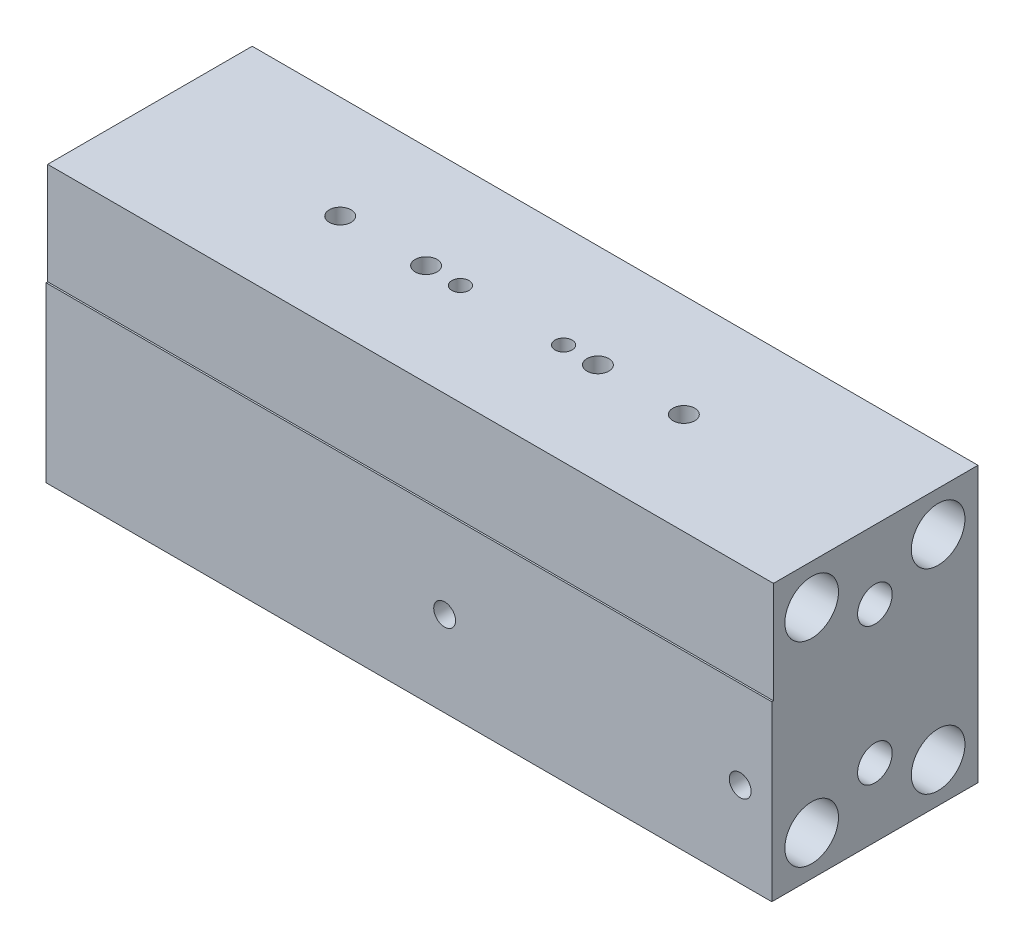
SolidWorks part; units mm, degrees
ref_plane "Front Plane" through (0, 0, 0) normal (0, 0, 1) x (1, 0, 0)
ref_plane "Top Plane" through (0, 0, 0) normal (0, 1, 0) x (1, 0, 0)
ref_plane "Right Plane" through (0, 0, 0) normal (1, 0, 0) x (0, 0, -1)
ref_plane "Plane1" through (0, 0, -19.05) normal (0, 0, 1) x (1, 0, 0)
ref_plane "Plane2" through (-67.056, 0, 0) normal (1, 0, 0) x (0, 0, -1)
ref_plane "Plane3" through (0, -25.4, 0) normal (0, 1, 0) x (-1, 0, 0)
sketch "Sketch1" plane through (0, 0, -19.05) normal (0, 0, 1) x (1, 0, 0)
  line L0 (-67.056, -25.4) -> (67.056, -25.4)
  line L1 (67.056, -25.4) -> (67.056, 25.4)
  line L2 (67.056, 25.4) -> (-67.056, 25.4)
  line L3 (-67.056, 25.4) -> (-67.056, -25.4)
  dimension "D1" = 134.112
  dimension "D2" = 50.8
  dimension "D3" = 25.4
  dimension "D4" = 67.056
extrude "Extrude1" add sketch "Sketch1" along normal blind 38.1
sketch "Sketch22" plane through (67.056, 0, 0) normal (1, 0, 0) x (0, 0, -1)
  line L0 (-19.05, 25.4) -> (-19.05, 6.604)
  line L1 (-19.05, 6.604) -> (-18.7452, 6.604)
  line L2 (-18.7452, 6.604) -> (-18.7452, 25.4)
  line L3 (-18.7452, 25.4) -> (-19.05, 25.4)
  line L4 (-19.05, -25.4) -> (-19.05, 25.4) construction
  line L5 (-19.05, 25.4) -> (19.05, 25.4) construction
  dimension "D1" = 18.796
  dimension "D2" = 0.3048
extrude "Cut-Extrude1" cut sketch "Sketch22" against normal blind 134.112
hole_wizard "1/8 (0.125) Diameter Hole3" positions "Sketch24" profile "Sketch23" hole size "1/8" standard "Ansi Inch"
sketch "Sketch24" plane through (0, 25.4, 0) normal (0, 1, 0) x (-1, 0, 0)
  point P0 (9.525, 0)
  point P1 (-9.525, 0)
  dimension "D1" = 19.05
  dimension "D2" = 9.525
sketch "Sketch23" plane through (-9.525, 25.4, 0) normal (1, 0, 0) x (0, 0, 1)
  line L0 (0, 0) -> (0, 7.3039)
  line L1 (0, 7.3039) -> (1.5875, 6.35)
  line L2 (1.5875, 6.35) -> (1.5875, 0)
  line L5 (1.5875, 0) -> (0, 0)
  line L10 (0, 7.3039) -> (-1.5875, 6.35) construction
  line L11 (0, -6.35) -> (0, 107.95) construction
  dimension "Hole Dia." = 3.175
  dimension "Hole Depth" = 6.35
  dimension "Drill Angle" = 118
sketch "Sketch26" plane through (67.056, 0, 0) normal (1, 0, 0) x (0, 0, -1)
  line L0 (-11.684, 18.034) -> (11.684, -18.034) construction
  line L1 (-11.684, 18.034) -> (11.684, 18.034) construction
  line L2 (-11.684, 18.034) -> (-11.684, -18.034) construction
  line L3 (-11.684, -18.034) -> (11.684, -18.034) construction
  line L4 (11.684, 18.034) -> (11.684, -18.034) construction
  line L5 (0, 12.7) -> (0, -12.7) construction
  circle A0 centre (-11.684, 18.034) radius 4.953
  circle A1 centre (11.684, 18.034) radius 4.953
  circle A2 centre (-11.684, -18.034) radius 4.953
  circle A3 centre (11.684, -18.034) radius 4.953
  circle A4 centre (0, 12.7) radius 3.2004
  circle A5 centre (0, -12.7) radius 3.2004
  dimension "D1" = 9.906
  dimension "D2" = 23.368
  dimension "D3" = 36.068
  dimension "D4" = 6.4008
  dimension "D5" = 25.4
extrude "Cut-Extrude2" cut sketch "Sketch26" against normal through all
hole_wizard "#8-32 Tapped Hole1" positions "Sketch28" profile "Sketch27" tap size "#8-32" standard "Ansi Inch"
sketch "Sketch28" plane through (0, 0, -19.05) normal (0, 0, -1) x (-1, 0, 0)
  point P0 (25.4, 7.9375)
  point P1 (-25.4, 7.9375)
  point P3 (-25.4, -7.9375)
  point P5 (25.4, -7.9375)
  dimension "D1" = 15.875
  dimension "D2" = 50.8
  dimension "D3" = 25.4
  dimension "D4" = 7.9375
sketch "Sketch27" plane through (-25.4, 7.9375, -19.05) normal (1, 0, 0) x (0, 1, 0)
  line L0 (0, 0) -> (0, 8.1346)
  line L1 (0, 8.1346) -> (1.7272, 7.1374)
  line L2 (1.7272, 7.1374) -> (1.7272, 0)
  line L5 (1.7272, 0) -> (0, 0)
  line L10 (0, 8.1346) -> (-1.7272, 7.1374) construction
  line L11 (0, -6.35) -> (0, 107.95) construction
  dimension "Tap Drill Dia." = 3.4544
  dimension "Tap Drill Depth" = 7.1374
  dimension "Drill Angle" = 120
hole_wizard "#10-32 Tapped Hole2" positions "Sketch30" profile "Sketch29" tap size "#10-32" standard "Ansi Inch"
sketch "Sketch30" plane through (0, 0, 19.05) normal (0, 0, 1) x (1, 0, 0)
  line L0 (-67.056, -25.4) -> (67.056, -25.4) construction
  point P0 (6.604, -9.652)
  point P1 (61.214, -9.652)
  dimension "D1" = 54.61
  dimension "D2" = 15.748
  dimension "D3" = 6.604
sketch "Sketch29" plane through (6.604, -9.652, 19.05) normal (1, 0, 0) x (0, -1, 0)
  line L0 (0, 0) -> (0, 13.2054)
  line L1 (0, 13.2054) -> (2.0193, 12.0396)
  line L2 (2.0193, 12.0396) -> (2.0193, 0)
  line L5 (2.0193, 0) -> (0, 0)
  line L10 (0, 13.2054) -> (-2.0193, 12.0396) construction
  line L11 (0, -6.35) -> (0, 107.95) construction
  dimension "Tap Drill Dia." = 4.0386
  dimension "Tap Drill Depth" = 12.0396
  dimension "Drill Angle" = 120
hole_wizard "#10-32 Tapped Hole3" positions "Sketch32" profile "Sketch31" tap size "#10-32" standard "Ansi Inch"
sketch "Sketch32" plane through (0, 25.4, 0) normal (0, 1, 0) x (-1, 0, 0)
  line L0 (-31.75, 0) -> (-15.875, 0) construction
  line L1 (-15.875, 0) -> (15.875, 0) construction
  line L2 (15.875, 0) -> (31.75, 0) construction
  point P0 (-15.875, 0)
  point P1 (31.75, 0)
  point P3 (15.875, 0)
  point P5 (-31.75, 0)
  dimension "D1" = 31.75
  dimension "D2" = 63.5
  dimension "D3" = 31.75
sketch "Sketch31" plane through (15.875, 25.4, 0) normal (1, 0, 0) x (0, 0, 1)
  line L0 (0, 0) -> (0, 9.9034)
  line L1 (0, 9.9034) -> (2.0193, 8.7376)
  line L2 (2.0193, 8.7376) -> (2.0193, 0)
  line L5 (2.0193, 0) -> (0, 0)
  line L10 (0, 9.9034) -> (-2.0193, 8.7376) construction
  line L11 (0, -6.35) -> (0, 107.95) construction
  dimension "Tap Drill Dia." = 4.0386
  dimension "Tap Drill Depth" = 8.7376
  dimension "Drill Angle" = 120
sketch "Sketch34" plane through (0, 0, -19.05) normal (0, 0, -1) x (-1, 0, 0)
  line L0 (0, 7.9375) -> (0, -7.9375) construction
  circle A0 centre (0, 7.9375) radius 1.6002
  circle A1 centre (0, -7.9375) radius 1.6002
  dimension "D1" = 3.2004
  dimension "D2" = 15.875
extrude "Cut-Extrude3" cut sketch "Sketch34" against normal blind 19.05
hole_wizard "1/8 (0.125) Diameter Hole2" positions "Sketch36" profile "Sketch35" hole size "1/8" standard "Ansi Inch"
sketch "Sketch36" plane through (0, 0, -19.05) normal (0, 0, -1) x (-1, 0, 0)
  line L0 (-31.75, 0) -> (31.75, 0) construction
  point P0 (-31.75, 0)
  point P1 (31.75, 0)
  dimension "D1" = 63.5
sketch "Sketch35" plane through (31.75, 0, -19.05) normal (1, 0, 0) x (0, 1, 0)
  line L0 (0, 0) -> (0, 5.7291)
  line L1 (0, 5.7291) -> (1.5875, 4.7752)
  line L2 (1.5875, 4.7752) -> (1.5875, 0)
  line L5 (1.5875, 0) -> (0, 0)
  line L10 (0, 5.7291) -> (-1.5875, 4.7752) construction
  line L11 (0, -6.35) -> (0, 107.95) construction
  dimension "Hole Dia." = 3.175
  dimension "Hole Depth" = 4.7752
  dimension "Drill Angle" = 118
